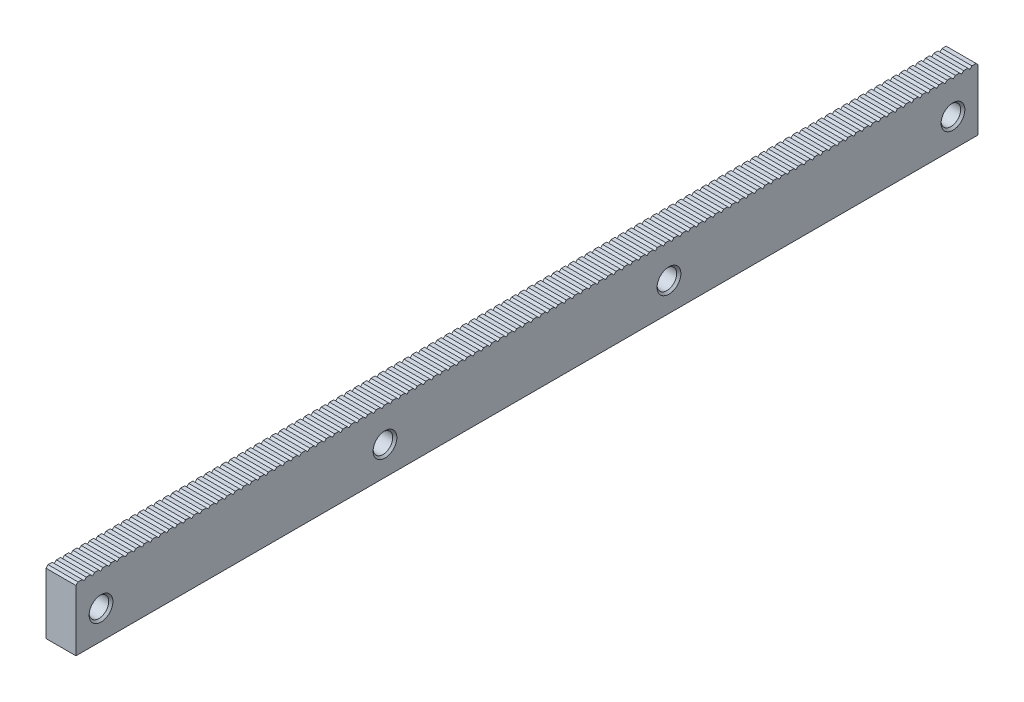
SolidWorks part; units mm, degrees
ref_plane "Front Plane" through (0, 0, 0) normal (0, 0, 1) x (1, 0, 0)
ref_plane "Top Plane" through (0, 0, 0) normal (0, 1, 0) x (1, 0, 0)
ref_plane "Right Plane" through (0, 0, 0) normal (1, 0, 0) x (0, 0, -1)
sketch "Sketch1" plane through (0, 0, 0) normal (1, 0, 0) x (0, 0, -1)
  line L1 (87.35, -6.1) -> (-87.35, -6.1)
  line L2 (87.35, -6.1) -> (87.35, 6.1)
  line L3 (87.35, 6.1) -> (-87.35, 6.1)
  line L4 (-87.35, -6.1) -> (-87.35, 6.1)
  line L5 (87.35, -6.1) -> (-87.35, 6.1) construction
  line L6 (87.35, 6.1) -> (-87.35, -6.1) construction
  point P0 (0, 0)
  dimension "D1" = 174.7
  dimension "D2" = 12.2
extrude "Boss-Extrude1" add sketch "Sketch1" along normal mid plane 5.8
sketch "Sketch2" plane through (0, 0, 0) normal (1, 0, 0) x (0, 0, -1)
  line L0 (-87.35, 5.7) -> (-87.75, 6.1)
  line L1 (-87.35, 6.1) -> (-87.35, -6.1) construction
  line L2 (-87.75, 6.1) -> (-86.95, 6.1)
  line L3 (87.35, 6.1) -> (-87.35, 6.1) construction
  line L4 (-86.95, 6.1) -> (-87.35, 5.7)
  line L5 (-87.35, -6.1) -> (87.35, -6.1) construction
  point P8 (-87.35, 5.7)
  dimension "D1" = 11.8
extrude "Cut-Extrude1" cut sketch "Sketch2" against normal mid plane 5.8
pattern_linear "LPattern1" count 110 spacing 1.603 along (0, -0.7071, -0.7071) of "Cut-Extrude1"
sketch "Sketch3" plane through (0, 0, 0) normal (1, 0, 0) x (0, 0, -1)
  line L0 (-87.35, -6.1) -> (87.35, -6.1) construction
  line L1 (-87.35, 5.7) -> (-87.35, -6.1) construction
  circle A0 centre (-82.5, -0.56) radius 1.9
  dimension "D3" = 3.8
  dimension "D1" = 5.54
  dimension "D2" = 4.85
extrude "Cut-Extrude2" cut sketch "Sketch3" against normal mid plane 5.8
chamfer "Chamfer1" distance 0.4 angle 45 2 edges at (-2.9, -0.56, 80.6) (2.9, -0.56, 80.6)
pattern_linear "LPattern2" count 4 spacing 55 along (0, 0, -1) of "Cut-Extrude2", "Chamfer1"
